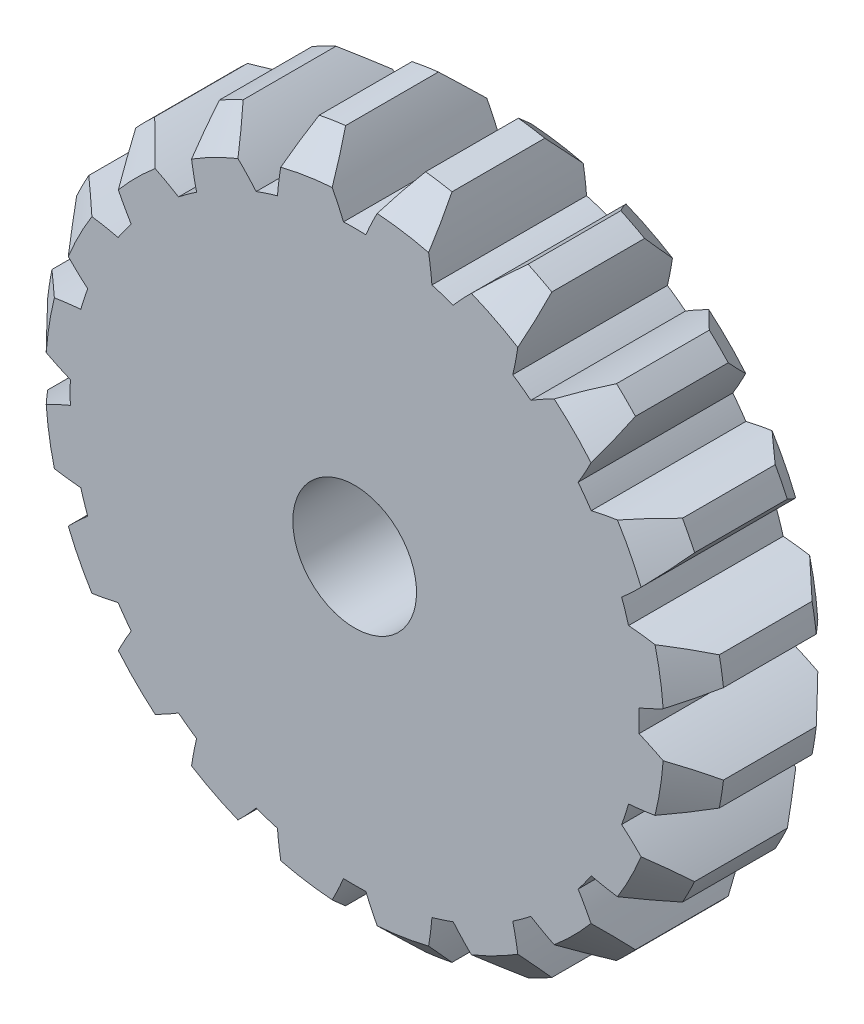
SolidWorks part; units mm, degrees
ref_plane "Plane1" through (0, 0, 0) normal (0, 0, 1) x (1, 0, 0)
ref_plane "Plane2" through (0, 0, 0) normal (0, 1, 0) x (-1, 0, 0)
ref_plane "Plane3" through (0, 0, 0) normal (1, 0, 0) x (0, 0, -1)
sketch "Sketch1" plane through (0, 0, 0) normal (0, 0, 1) x (1, 0, 0)
  circle A0 centre (0, 0) radius 11
  dimension "D1" = 22
extrude "Gear Blank" add sketch "Sketch1" along normal mid plane 5
chamfer "Front Gear Chamfer" distance 1 angle 45 1 edges at (11, 0, 2.5)
chamfer "Rear Gear Chamfer" distance 1 angle 45 1 edges at (11, 0, -2.5)
sketch "Sketch2" plane through (0, 0, 0) normal (0, 0, 1) x (1, 0, 0)
  line L0 (0, 11) -> (0, 0) construction
  line L1 (0, 0) -> (9.6524, 0) construction
  line L2 (0, 0) -> (-1.2929, 10.9238) construction
  line L3 (0, 0) -> (1.2929, 10.9238) construction
  line L4 (0, 0) -> (0.3612, 9.1929) construction
  line L5 (0, 0) -> (-0.3612, 9.1929) construction
  arc A1 (1.2929, 10.9238) -> (-1.2929, 10.9238) centre (0, 0) ccw
  arc A2 (1.2929, 10.9238) -> (0.3612, 9.1929) centre (9.5897, 5.3414) ccw
  arc A3 (-1.2929, 10.9238) -> (-0.3612, 9.1929) centre (-9.5897, 5.3414) cw
  arc A4 (-0.3612, 9.1929) -> (0.3612, 9.1929) centre (0, 0) cw
  circle A5 centre (0, 0) radius 11 construction
  dimension "D2" = 10
  dimension "D1" = 18.4
  dimension "D3" = 90
  dimension "D4" = 13.5
  dimension "D5" = 4.5
extrude "Tooth Cut" cut sketch "Sketch2" against normal mid plane 5
pattern_circular "Tooth Copies" count 20 over 360 about axis through (0, 0, 0) along (0, 0, 1) of "Tooth Cut"
sketch "Sketch4" plane through (0, 0, -2.5) normal (0, 0, -1) x (-1, 0, 0)
  circle A0 centre (0, 0) radius 2
  arc A1 (0.3612, 9.1929) -> (-0.3612, 9.1929) centre (0, 0) ccw construction
  dimension "D1" = 4
extrude "Extrude1" cut sketch "Sketch4" against normal through all
equation "\"D2@Tooth Copies\"=360/\"D1@Tooth Copies\""
equation "\"D4@Sketch2\" = (3/4) * \"D2@Tooth Copies\""
equation "\"D5@Sketch2\"= \"D2@Tooth Copies\" - \"D4@Sketch2\""
equation "\"D1@Sketch2\" = \"D1@Sketch1\" - 3.6"
equation "\"D1@Tooth Cut\" = \"D1@Gear Blank\""
